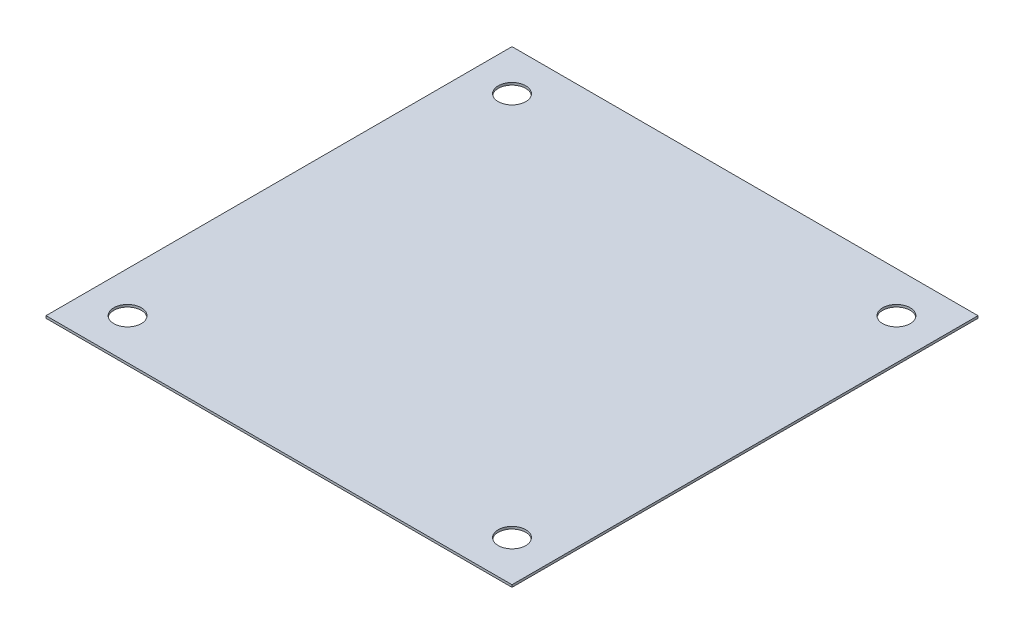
SolidWorks part; units mm, degrees
ref_plane "Front Plane" through (0, 0, 0) normal (0, 0, 1) x (1, 0, 0)
ref_plane "Top Plane" through (0, 0, 0) normal (0, 1, 0) x (1, 0, 0)
ref_plane "Right Plane" through (0, 0, 0) normal (1, 0, 0) x (0, 0, -1)
body saved out of another part "Stock-Sarrus Mechanism-1"
sketch "Sketch1" plane through (0, 2.667, 0) normal (0, 1, 0) x (1, 0, 0)
  line L3 (-20.955, -20.955) -> (20.955, -20.955) construction
  line L4 (-20.955, -20.955) -> (-20.955, 20.955) construction
  line L6 (-20.955, 20.955) -> (20.955, 20.955) construction
  line L7 (20.955, -20.955) -> (20.955, 20.955) construction
  line L8 (-20.955, -20.955) -> (20.955, 20.955) construction
  line L9 (-20.955, 20.955) -> (20.955, -20.955) construction
  circle A5 centre (20.955, 20.955) radius 1.4999
  circle A6 centre (-20.955, 20.955) radius 1.4999
  circle A7 centre (-20.955, -20.955) radius 1.4999
  circle A8 centre (20.955, -20.955) radius 1.4999
  point P0 (0, 0)
  dimension "D1" = 41.91
  dimension "D3" = 2.9997
  dimension "D2" = 41.91
extrude "Cut-Extrude1" cut sketch "Sketch1" against normal through all
